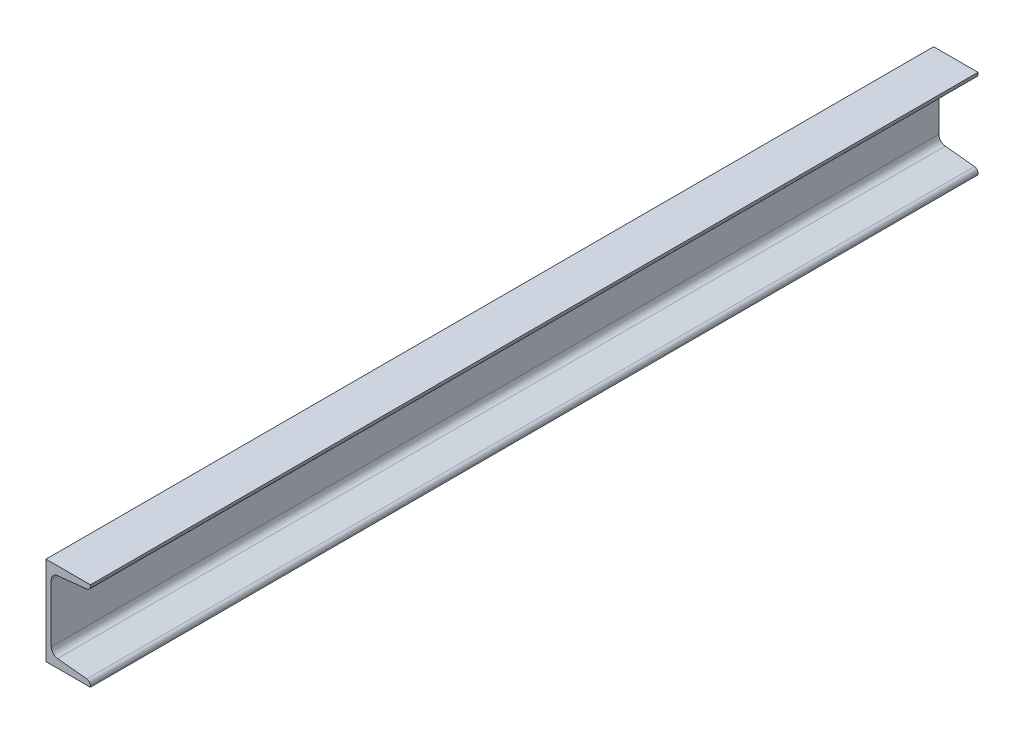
SolidWorks part; units mm, degrees
ref_plane "Alzado" through (0, 0, 0) normal (0, 0, 1) x (1, 0, 0)
ref_plane "Planta" through (0, 0, 0) normal (0, 1, 0) x (1, 0, 0)
ref_plane "Vista lateral" through (0, 0, 0) normal (1, 0, 0) x (0, 0, -1)
sketch "Croquis1" plane through (0, 0, 0) normal (0, 0, 1) x (1, 0, 0)
  line L0 (0, 0) -> (0, 100)
  line L1 (0, 100) -> (50, 100)
  line L2 (0, 0) -> (50, 0)
  line L12 (5.9, 82.4792) -> (5.9, 17.5208)
  line L15 (50, 100) -> (50, 98.3694)
  line L16 (50, 0) -> (50, 1.6306)
  line L17 (13.0638, 90.4354) -> (45.9704, 93.894)
  line L18 (13.0638, 9.5646) -> (45.9704, 6.106)
  arc A9 (5.9, 17.5208) -> (13.0638, 9.5646) centre (13.9, 17.5208) ccw
  arc A10 (5.9, 82.4792) -> (13.0638, 90.4354) centre (13.9, 82.4792) cw
  arc A11 (50, 98.3694) -> (45.9704, 93.894) centre (45.5, 98.3694) cw
  arc A12 (50, 1.6306) -> (45.9704, 6.106) centre (45.5, 1.6306) ccw
extrude "Extruir1" add sketch "Croquis1" along normal blind 1000
